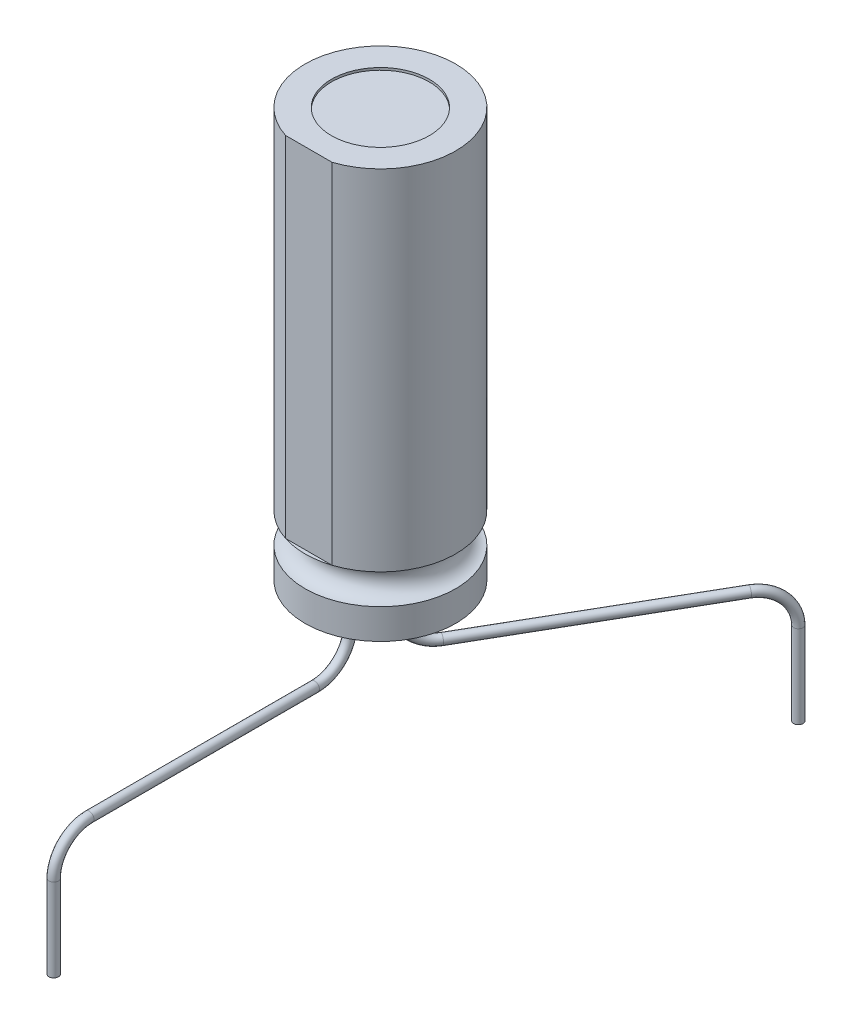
SolidWorks part; units mm, degrees
ref_plane "Face" through (0, 0, 0) normal (0, 0, 1) x (1, 0, 0)
ref_plane "Dessus" through (0, 0, 0) normal (0, 1, 0) x (1, 0, 0)
ref_plane "Droite" through (0, 0, 0) normal (1, 0, 0) x (0, 0, -1)
sketch "Esquisse1" plane through (0, 0, 0) normal (0, 0, 1) x (1, 0, 0)
  line L0 (0, 48.4017) -> (0, -33.7592) construction
  line L1 (0, 39.5164) -> (6.35, 39.5164)
  line L2 (6.35, 39.5164) -> (6.35, 10.0964)
  line L3 (6.35, 7.5564) -> (6.35, 5.0164)
  line L4 (6.35, 5.0164) -> (0, 5.0164)
  line L5 (0, 5.0164) -> (0, 39.5164)
  arc A0 (6.35, 10.0964) -> (6.35, 7.5564) centre (6.35, 8.8264) ccw
  dimension "D4" = 1.27
  dimension "D1" = 34.5
  dimension "D2" = 6.35
  dimension "D3" = 2.54
revolve "Révolution1" add sketch "Esquisse1" angle 360 about L0
sketch "Esquisse2" plane through (0, 39.5164, 0) normal (0, 1, 0) x (-1, 0, 0)
  circle A0 centre (0, 0) radius 4.125
  dimension "D1" = 8.25
extrude "Enlèv. mat.-Extru.1" cut sketch "Esquisse2" against normal blind 0.2
sketch "Esquisse3" plane through (0, 5.0164, 0) normal (0, -1, 0) x (1, 0, 0)
  line L0 (4.0351, 0) -> (-4.283, 0) construction
  circle A0 centre (0, 2.54) radius 0.4
  dimension "D1" = 0.8
ref_plane "Plan1" through (0, 0, 6.54) normal (0, 0, 1) x (1, 0, 0)
sketch "Esquisse5" plane through (0, 0, 6.54) normal (0, 0, 1) x (1, 0, 0)
  line L0 (6.35, 39.5164) -> (-6.35, 39.5164) construction
  line L1 (-2.5, 39.5164) -> (2.5, 39.5164)
  line L2 (-2.5, 39.5164) -> (-2.5, 10.0964)
  line L3 (-2.5, 10.0964) -> (2.5, 10.0964)
  line L4 (2.5, 39.5164) -> (2.5, 10.0964)
  line L5 (6.35, 10.0964) -> (-6.35, 10.0964) construction
  line L6 (0, 50.571) -> (0, 0) construction
  dimension "D1" = 5
extrude "Enlèv. mat.-Extru.4" cut sketch "Esquisse5" against normal blind 0.5
sketch "Esquisse6" plane through (0, 0, 0) normal (1, 0, 0) x (0, 0, -1)
  line L0 (-2.54, 5.0164) -> (-2.54, 3.0164)
  line L1 (-5.54, 0.0164) -> (-24.54, 0.0164)
  line L2 (-27.54, -2.9836) -> (-27.54, -9.9836)
  arc A0 (-5.54, 0.0164) -> (-2.54, 3.0164) centre (-5.54, 3.0164) ccw
  arc A1 (-27.54, -2.9836) -> (-24.54, 0.0164) centre (-24.54, -2.9836) cw
  point P7 (-2.54, 0.0164)
  point P10 (-27.54, 0.0164)
  dimension "D4" = 3
  dimension "D1" = 5
  dimension "D2" = 25
  dimension "D3" = 10
sweep "Balayage3" add profiles "Esquisse3" path "Esquisse6"
sketch "Esquisse7" plane through (0, 0, 0) normal (1, 0, 0) x (0, 0, -1)
  line L0 (0, 0) -> (0, 56.4499) construction
ref_plane "Plan2" through (0, 0, 0) normal (0.866, 0, 0.5) x (0.5, 0, -0.866)
sketch "Esquisse8" plane through (0, 5.0164, 0) normal (0, -1, 0) x (1, 0, 0)
  line L0 (25, -43.3013) -> (-25, 43.3013) construction
  circle A0 centre (0.395, -0.6841) radius 0.4
  dimension "D1" = 0.8
sketch "Esquisse9" plane through (0, 0, 0) normal (0.866, 0, 0.5) x (0.5, 0, -0.866)
  line L0 (0.79, 5.0164) -> (0.79, 3.0164)
  line L1 (3.79, 0.0164) -> (22.79, 0.0164)
  line L2 (25.79, -2.9836) -> (25.79, -9.9836)
  arc A0 (3.79, 0.0164) -> (0.79, 3.0164) centre (3.79, 3.0164) cw
  arc A1 (25.79, -2.9836) -> (22.79, 0.0164) centre (22.79, -2.9836) ccw
  point P7 (0.79, 0.0164)
  point P10 (25.79, 0.0164)
  dimension "D4" = 3
  dimension "D1" = 10
  dimension "D2" = 25
  dimension "D3" = 5
sweep "Balayage4" add profiles "Esquisse8" path "Esquisse9"
